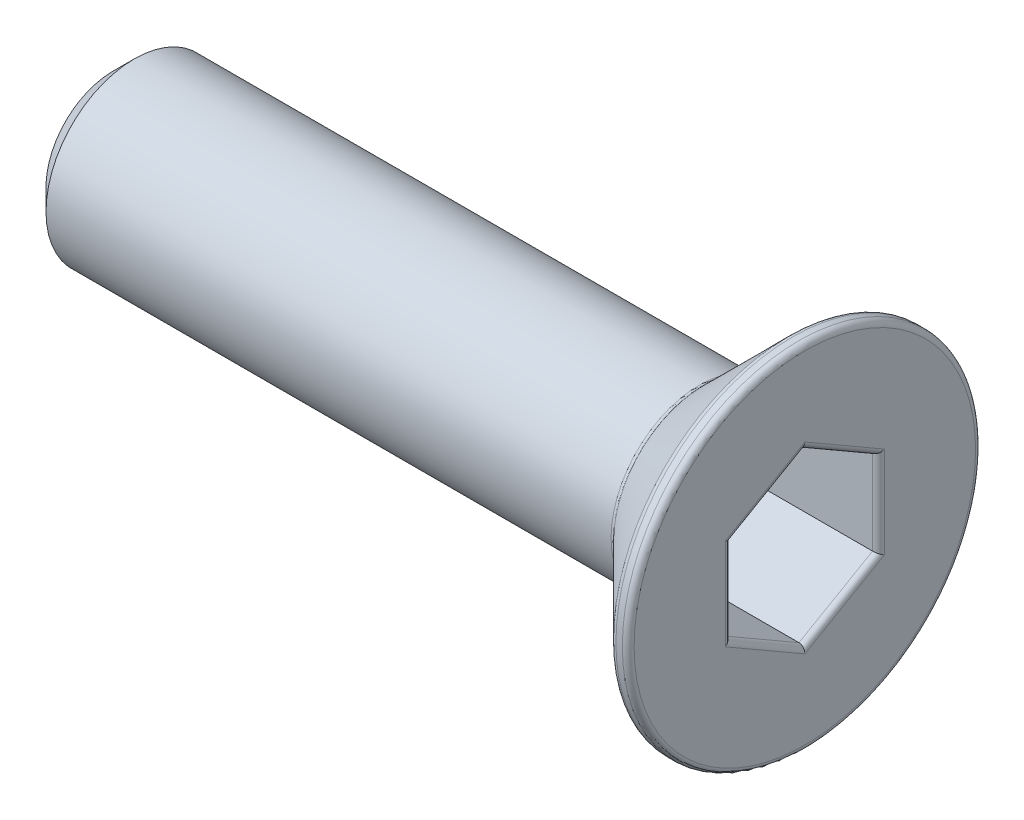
SolidWorks part; units mm, degrees
ref_plane "Plan1" through (0, 0, 0) normal (0, 0, 1) x (1, 0, 0)
ref_plane "Plan2" through (0, 0, 0) normal (0, 1, 0) x (1, 0, 0)
ref_plane "Plan3" through (0, 0, 0) normal (1, 0, 0) x (0, 0, -1)
sketch "Esquisse1" plane through (0, 0, 0) normal (0, 0, 1) x (1, 0, 0)
  line L0 (0, 0) -> (67.5598, 0) construction
  line L1 (0, 0) -> (0, 1.5)
  line L2 (0, 1.5) -> (10, 1.5)
  line L3 (10, 1.5) -> (11.5, 3)
  line L4 (11.5, 3) -> (11.75, 3)
  line L5 (11.75, 3) -> (11.75, 0)
  line L6 (0, 0) -> (11.75, 0)
  dimension "D1" = 1.5
  dimension "D2" = 10
  dimension "D3" = 45
  dimension "D4" = 3
  dimension "D5" = 0.25
revolve "Révolution1" add sketch "Esquisse1" angle 360 about L0
sketch "Esquisse2" plane through (11.75, 0, 0) normal (1, 0, 0) x (0, 0, -1)
  line L1 (0, -1.4434) -> (1.25, -0.7217)
  line L2 (1.25, -0.7217) -> (1.25, 0.7217)
  line L3 (1.25, 0.7217) -> (0, 1.4434)
  line L4 (0, 1.4434) -> (-1.25, 0.7217)
  line L5 (-1.25, 0.7217) -> (-1.25, -0.7217)
  line L6 (-1.25, -0.7217) -> (0, -1.4434)
  circle A0 centre (0, 0) radius 1.25 construction
  dimension "D1" = 2.5
extrude "Enlèv. mat.-Extru.1" cut sketch "Esquisse2" against normal blind 2
sketch "Esquisse5" plane through (0, 0, 0) normal (0, 0, 1) x (1, 0, 0)
  line L0 (0, 0) -> (3.723, 0) construction
  line L2 (1.1355, 2.2742) -> (-0.6932, 2.2742)
  line L3 (-0.6932, 2.2742) -> (-0.6932, 0)
  line L7 (-0.3608, 0.7779) -> (-0.3608, 0)
  line L8 (-0.3608, 0) -> (-0.6932, 0)
  line L9 (-0.3608, 0.7779) -> (1.1355, 2.2742)
revolve "Enlèvement de matière-Révolution1" cut sketch "Esquisse5" angle 360 about L0
fillet "Congé1" radius 0.1
